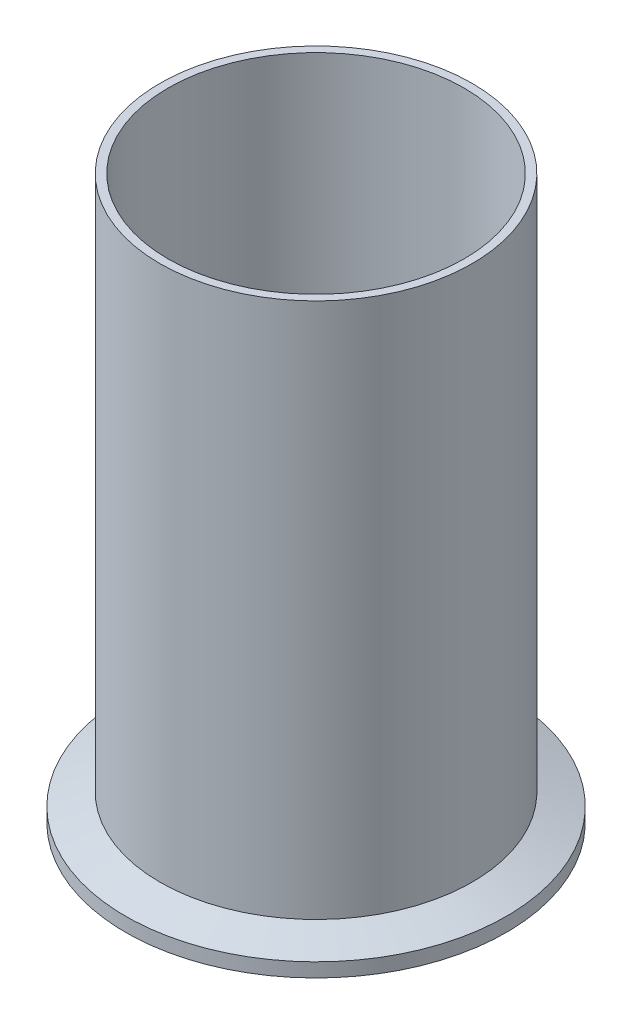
SolidWorks part; units mm, degrees
ref_plane "Front Plane" through (0, 0, 0) normal (0, 0, 1) x (1, 0, 0)
ref_plane "Top Plane" through (0, 0, 0) normal (0, 1, 0) x (1, 0, 0)
ref_plane "Right Plane" through (0, 0, 0) normal (1, 0, 0) x (0, 0, -1)
sketch "Sketch1" plane through (0, 0, 0) normal (0, 0, 1) x (1, 0, 0)
  line L0 (0, 0) -> (0, 114.3) construction
  line L1 (0, 114.3) -> (-31.75, 114.3)
  line L2 (-31.75, 114.3) -> (-31.75, 5.3779)
  line L3 (-31.75, 5.3779) -> (-38.7096, 2.8448)
  line L4 (-38.7096, 2.8448) -> (-38.7096, 0)
  line L5 (-38.7096, 0) -> (-37.1367, 0)
  line L6 (-33.5007, 0) -> (0, 0)
  line L7 (0, 0) -> (0, 114.3)
  line L8 (0, 114.3) -> (-30.099, 114.3)
  line L9 (-30.099, 114.3) -> (-30.099, 0)
  line L10 (-30.099, 0) -> (0, 0)
  line L11 (0, 0) -> (-0.1846, 0.0129)
  arc A0 (-36.4142, 0.4745) -> (-34.2232, 0.4745) centre (-35.3187, 0) cw
  arc A1 (-33.5007, 0) -> (-34.2232, 0.4745) centre (-33.5007, 0.7874) cw
  arc A2 (-36.4142, 0.4745) -> (-37.1367, 0) centre (-37.1367, 0.7874) cw
  point P12 (-34.1249, 0)
  dimension "D6" = 1.1938
  dimension "D7" = 0.7874
  dimension "D1" = 31.75
  dimension "D2" = 2.8448
  dimension "D3" = 38.7096
  dimension "D4" = 70
  dimension "D5" = 35.3187
  dimension "D8" = 1.651
  dimension "D9" = 114.3
revolve "Revolve2" add sketch "Sketch1" angle 360 about L0
